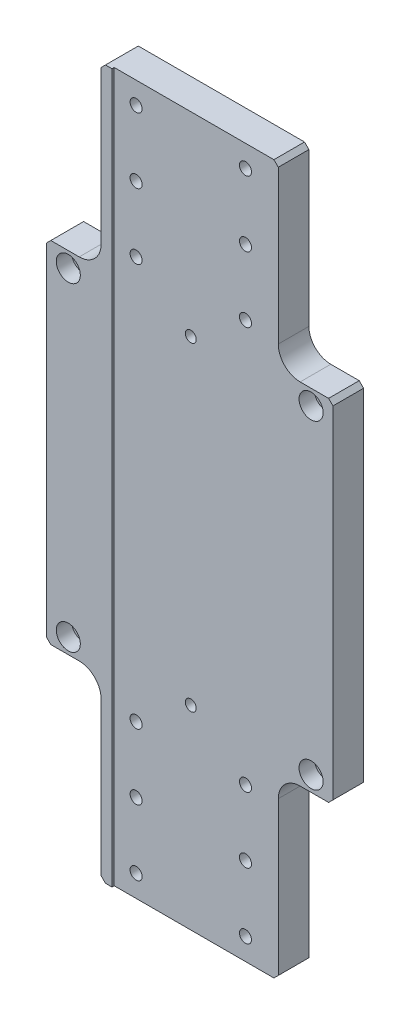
SolidWorks part; units mm, degrees
ref_plane "정면" through (0, 0, 0) normal (0, 0, 1) x (1, 0, 0)
ref_plane "윗면" through (0, 0, 0) normal (0, 1, 0) x (1, 0, 0)
ref_plane "우측면" through (0, 0, 0) normal (1, 0, 0) x (0, 0, -1)
sketch "스케치1" plane through (0, 0, 0) normal (0, 0, 1) x (1, 0, 0)
  line L12 (40, 80) -> (65, 80)
  line L13 (-40, 162) -> (40, 162)
  line L14 (-40, 162) -> (-40, 80)
  line L15 (-40, -162) -> (40, -162)
  line L16 (40, 162) -> (40, 80)
  line L17 (-40, 162) -> (40, -162) construction
  line L18 (-40, -162) -> (40, 162) construction
  line L19 (65, 80) -> (65, -80)
  line L20 (65, -80) -> (40, -80)
  line L21 (-40, 80) -> (-65, 80)
  line L22 (-65, 80) -> (-65, -80)
  line L23 (-65, -80) -> (-40, -80)
  line L24 (-40, -80) -> (-40, -162)
  line L25 (40, -80) -> (40, -162)
  point P0 (0, 0)
  dimension "D1" = 82
  dimension "D2" = 160
  dimension "D3" = 82
  dimension "D4" = 80
  dimension "D5" = 25
  dimension "D6" = 25
extrude "보스-돌출1" add sketch "스케치1" along normal mid plane 15
sketch "스케치2" plane through (0, 0, 7.5) normal (0, 0, 1) x (1, 0, 0)
  line L6 (40, 162) -> (-40, 162) construction
  line L7 (-35, 162) -> (65, 162)
  line L8 (-35, 162) -> (-35, -162)
  line L9 (-35, -162) -> (65, -162)
  line L10 (65, 162) -> (65, -162)
  line L11 (65, -80) -> (65, 80) construction
  line L12 (-40, -162) -> (40, -162) construction
  line L13 (-65, 80) -> (-65, -80) construction
  dimension "D1" = 30
extrude "컷-돌출1" cut sketch "스케치2" against normal blind 1
hole_wizard "M5 소켓 머리 캡 나사용 카운터보어1" positions "스케치3" profile "스케치4" counterbore size "M5" standard "KS"
sketch "스케치3" plane through (0, 0, -7.5) normal (0, 0, -1) x (-1, 0, 0)
  line L0 (-40, 80) -> (-40, 162) construction
  line L2 (-40, 162) -> (40, 162) construction
  point P0 (-25, 152)
  point P2 (25, 152)
  point P4 (-25, 122)
  point P6 (25, 122)
  point P8 (-25, 92)
  point P10 (25, 92)
  dimension "D1" = 15
  dimension "D2" = 50
  dimension "D3" = 10
  dimension "D4" = 30
  dimension "D5" = 30
sketch "스케치4" plane through (25, 152, -7.5) normal (1, 0, 0) x (0, 1, 0)
  line L0 (0, 0) -> (0, 15)
  line L1 (0, 15) -> (2.75, 15)
  line L3 (2.75, 15) -> (2.75, 8)
  line L4 (2.75, 8) -> (4.75, 8)
  line L5 (4.75, 8) -> (4.75, 0)
  line L7 (4.75, 0) -> (0, 0)
  line L11 (0, -6.35) -> (0, 107.95) construction
  dimension "관통 구멍 지름" = 5.5
  dimension "관통 구멍 깊이" = 15
  dimension "카운터보어 지름" = 9.5
  dimension "카운터보어 깊이" = 8
pattern_linear "선형 패턴1" count 2 spacing 244 along (0, -1, 0) of "M5 소켓 머리 캡 나사용 카운터보어1"
hole_wizard "M6 소켓 머리 캡 나사용 카운터보어1" positions "스케치5" profile "스케치6" counterbore size "M6" standard "KS"
sketch "스케치5" plane through (0, 0, 7.5) normal (0, 0, 1) x (1, 0, 0)
  line L0 (-65, 80) -> (-65, -80) construction
  line L1 (40, 162) -> (-35, 162) construction
  point P0 (-55, 73)
  point P2 (-55, -73)
  dimension "D1" = 10
  dimension "D2" = 89
  dimension "D3" = 146
sketch "스케치6" plane through (-55, 73, 7.5) normal (1, 0, 0) x (0, -1, 0)
  line L0 (0, 0) -> (0, 15)
  line L1 (0, 15) -> (3.3, 15)
  line L3 (3.3, 15) -> (3.3, 7)
  line L4 (3.3, 7) -> (5.5, 7)
  line L5 (5.5, 7) -> (5.5, 0)
  line L7 (5.5, 0) -> (0, 0)
  line L11 (0, -6.35) -> (0, 107.95) construction
  dimension "관통 구멍 지름" = 6.6
  dimension "관통 구멍 깊이" = 15
  dimension "카운터보어 지름" = 11
  dimension "카운터보어 깊이" = 7
hole_wizard "M6 소켓 머리 캡 나사용 카운터보어2" positions "스케치7" profile "스케치8" counterbore size "M6" standard "KS"
sketch "스케치7" plane through (0, 0, 6.5) normal (0, 0, 1) x (1, 0, 0)
  line L0 (40, 162) -> (-35, 162) construction
  line L1 (65, -80) -> (65, 80) construction
  point P0 (55, 73)
  point P2 (55, -73)
  dimension "D1" = 146
  dimension "D2" = 89
  dimension "D3" = 10
sketch "스케치8" plane through (55, 73, 6.5) normal (1, 0, 0) x (0, -1, 0)
  line L0 (0, 0) -> (0, 14)
  line L1 (0, 14) -> (3.3, 14)
  line L3 (3.3, 14) -> (3.3, 7)
  line L4 (3.3, 7) -> (5.5, 7)
  line L5 (5.5, 7) -> (5.5, 0)
  line L7 (5.5, 0) -> (0, 0)
  line L11 (0, -6.35) -> (0, 107.95) construction
  dimension "관통 구멍 지름" = 6.6
  dimension "관통 구멍 깊이" = 14
  dimension "카운터보어 지름" = 11
  dimension "카운터보어 깊이" = 7
hole_wizard "Ø5.0mm 맞춤핀 구멍1" positions "스케치9" profile "스케치10" hole size "Ø5.0" standard "ISO"
sketch "스케치9" plane through (0, 0, 6.5) normal (0, 0, 1) x (1, 0, 0)
  line L0 (0, 0) -> (0, 170.371) construction
  line L1 (40, 162) -> (-35, 162) construction
  point P5 (0, 73)
  point P7 (0, -73)
  dimension "D1" = 89
  dimension "D2" = 146
sketch "스케치10" plane through (0, -73, 6.5) normal (1, 0, 0) x (0, -1, 0)
  line L0 (0, 0) -> (0, 14)
  line L1 (0, 14) -> (2.5, 14)
  line L2 (2.5, 14) -> (2.5, 0)
  line L5 (2.5, 0) -> (0, 0)
  line L11 (0, -6.35) -> (0, 107.95) construction
  dimension "관통 구멍 지름" = 5
  dimension "관통 구멍 깊이" = 14
fillet "필렛1" radius 10 4 edges at (40, -80, -0.5) (-40, -80, 0) (-40, 80, 0) (40, 80, -0.5)
chamfer "모따기1" distance 2 angle 45 8 edges at (-40, -162, 0) (-65, -80, 0) (-65, 80, 0) (-40, 162, 0) (40, 162, -0.5) (65, 80, -0.5) (65, -80, -0.5) (40, -162, -0.5)
